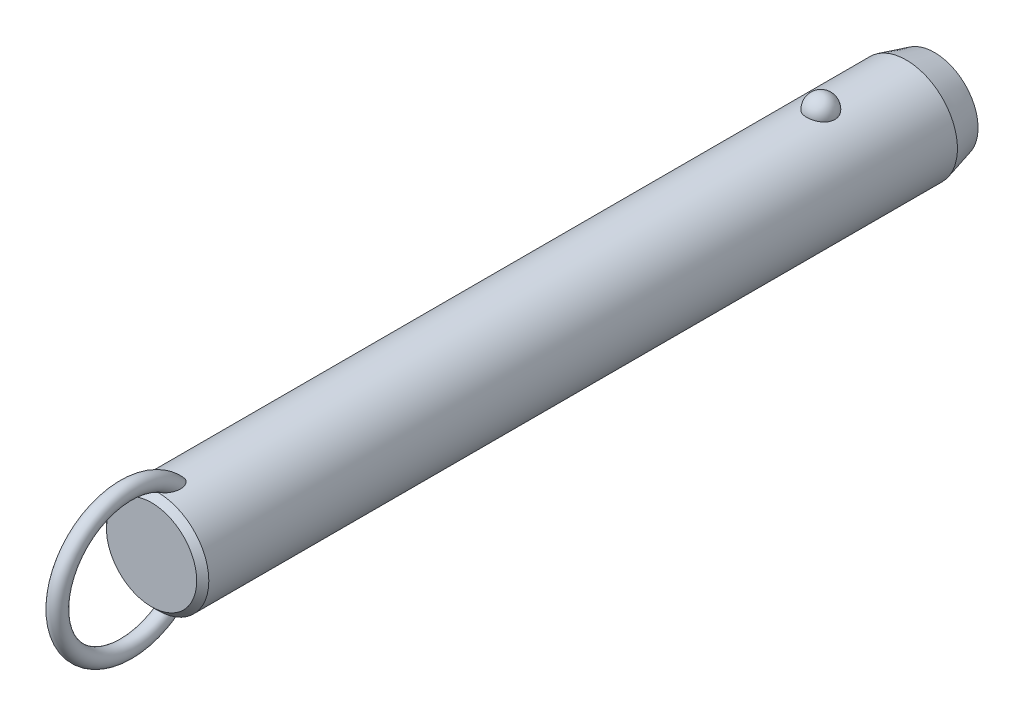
SolidWorks part; units mm, degrees
ref_plane "Front Plane" through (0, 0, 0) normal (0, 0, 1) x (1, 0, 0)
ref_plane "Top Plane" through (0, 0, 0) normal (0, 1, 0) x (1, 0, 0)
ref_plane "Right Plane" through (0, 0, 0) normal (1, 0, 0) x (0, 0, -1)
sketch "Sketch2" plane through (0, 0, 0) normal (0, 0, 1) x (1, 0, 0)
  circle A0 centre (0, 0) radius 12.7
  point P3 (0, 12.7)
  dimension "D1" = 25.4
extrude "Boss-Extrude1" add sketch "Sketch2" along normal blind 149.9
sketch "Sketch3" plane through (0, 0, 0) normal (0, 0, -1) x (-1, 0, 0)
  circle A0 centre (0, 0) radius 12.7
  dimension "D1" = 25.4
extrude "Boss-Extrude2" add sketch "Sketch3" along normal blind 31.7
chamfer "Chamfer1" distance 7 angle 15 1 edges at (-12.7, 0, -31.7)
sketch "Sketch12" plane through (0, 0, 0) normal (1, 0, 0) x (0, 0, -1)
  line L0 (-149.9, 12.7) -> (-149.9, -12.7) construction
  point P0 (-149.9, 0)
sketch "Sketch13" plane through (0, 0, 0) normal (1, 0, 0) x (0, 0, -1)
  circle A0 centre (-168.95, 0) radius 19.05
  point P2 (-149.9, 0)
  dimension "D1" = 38.1
sketch "Sketch14" plane through (0, 0, 0) normal (0, 1, 0) x (1, 0, 0)
  circle A0 centre (0, -151.9) radius 2
  point P2 (0, -149.9)
  dimension "D1" = 4
sweep "Sweep1" add profiles "Sketch14" path "Sketch13"
sketch "Sketch15" plane through (0, 0, 149.9) normal (0, 0, 1) x (1, 0, 0)
  circle A0 centre (0, 0) radius 12.7
  dimension "D1" = 25.4
extrude "Boss-Extrude3" add sketch "Sketch15" along normal blind 12.7
chamfer "Chamfer2" distance 1.5 angle 45 1 edges at (12.7, 0, 162.6)
sketch "Sketch18" plane through (0, 0, 0) normal (1, 0, 0) x (0, 0, -1)
  line L0 (24.7, 12.7) -> (-154.751, 12.7) construction
  line L1 (3.5, 16.2) -> (3.5, 9.2)
  line L2 (-154.751, -12.7) -> (24.7, -12.7) construction
  arc A0 (3.5, 16.2) -> (3.5, 9.2) centre (3.5, 12.7) ccw
  point P4 (0, 12.7)
  dimension "D1" = 28.9
revolve "Revolve1" add sketch "Sketch18" angle 360 about L1
